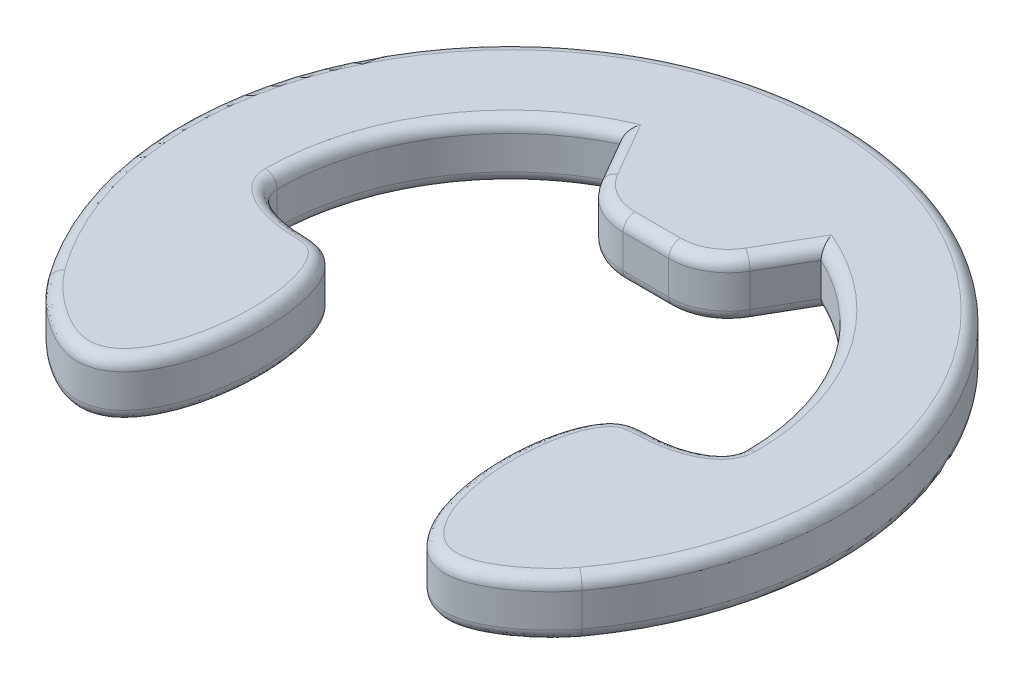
SolidWorks part; units mm, degrees
ref_plane "Front Plane" through (0, 0, 0) normal (0, 0, 1) x (1, 0, 0)
ref_plane "Top Plane" through (0, 0, 0) normal (0, 1, 0) x (1, 0, 0)
ref_plane "Right Plane" through (0, 0, 0) normal (1, 0, 0) x (0, 0, -1)
sketch "Sketch1" plane through (0, 0, 0) normal (0, 1, 0) x (1, 0, 0)
  line L0 (-3.5306, 0) -> (3.5306, 0) construction
  line L1 (0, 3.5306) -> (0, -3.5306) construction
  line L2 (0, 3.5306) -> (3.5306, 3.5306) construction
  line L3 (3.5306, 3.5306) -> (-3.5306, 3.5306) construction
  line L4 (-0.6096, 1.4478) -> (0.6096, 1.4478)
  line L5 (-0.6096, 1.4478) -> (-1.071, 2.247)
  line L6 (0.6096, 1.4478) -> (1.071, 2.247)
  line L7 (-1.27, 0) -> (-1.27, -3.5306) construction
  line L8 (1.27, 0) -> (1.27, -3.5306) construction
  arc A0 (2.8499, -2.084) -> (-2.8499, -2.084) centre (0, 0) ccw
  arc A1 (-1.071, 2.247) -> (-2.4892, 0) centre (0, 0) ccw
  arc A3 (2.4892, 0) -> (1.071, 2.247) centre (0, 0) ccw
  spline S0 degree 3 poles (-2.4892, 0) (-2.4892, -0.1856) (-2.0191, -0.3896) (-1.0183, -0.1919) (-1.1896, -3.5133) (-2.6848, -2.3098) (-2.8499, -2.084) knots 0 0 0 0 0.116807 0.233954 0.821674 0.972416 0.972416 0.972416 0.972416
  spline S1 degree 3 poles (2.4892, 0) (2.4892, -0.1856) (2.0191, -0.3896) (1.0183, -0.1919) (1.1896, -3.5133) (2.6848, -2.3098) (2.8499, -2.084) knots 0 0 0 0 0.116807 0.233954 0.821674 0.972416 0.972416 0.972416 0.972416
  point P19 (-1.3458, -0.7846)
  dimension "D1" = 7.0612
  dimension "D2" = 1.0414
  dimension "D8" = 4.8082
  dimension "D3" = 2.0828
  dimension "D4" = 60
  dimension "D5" = 1.2192
  dimension "D6" = 1.27
  dimension "D7" = 1.27
  dimension "D9" = 0.3244
  dimension "D10" = 0.3854
  dimension "D11" = 0.7846
  dimension "D12" = 2.6316
  dimension "D13" = 0.8605
  dimension "D14" = 0.0758
  dimension "D15" = 0.3491
extrude "Clip" add sketch "Sketch1" along normal mid plane 0.6096
fillet "Surface fillet" radius 0.127 16 edges at (-2.105, -0.3048, -1.3286) (-0.8403, -0.3048, -1.8474) (0, -0.3048, -1.4478) (0.8403, -0.3048, -1.8474) (0, -0.3048, -3.5306) (-0.8403, 0.3048, -1.8474) (-2.105, 0.3048, -1.3286) (0.8403, 0.3048, -1.8474) (0, 0.3048, -1.4478) (0, 0.3048, -3.5306) (2.105, -0.3048, -1.3286) (2.105, 0.3048, -1.3286)
fillet "Flange fillet" radius 0.635 6 edges at (-0.5881, -0.2676, -1.485) (-0.5881, 0.2676, -1.485) (0.5881, -0.2676, -1.485) (0.5881, 0.2676, -1.485) (0.6096, 0, -1.4478) (-0.6096, 0, -1.4478)
